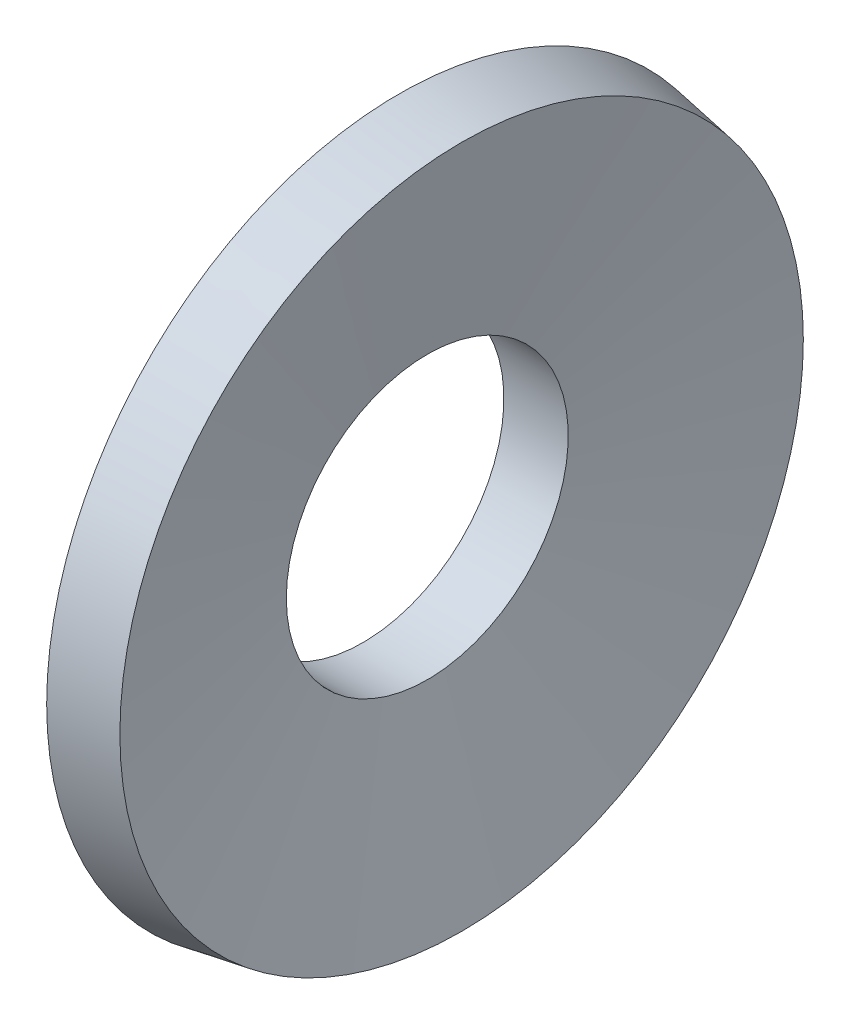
SolidWorks part; units mm, degrees
ref_plane "Plan1" through (0, 0, 0) normal (0, 0, 1) x (1, 0, 0)
ref_plane "Plan2" through (0, 0, 0) normal (0, 1, 0) x (1, 0, 0)
ref_plane "Plan3" through (0, 0, 0) normal (1, 0, 0) x (0, 0, -1)
sketch "Esquisse1" plane through (0, 0, 0) normal (0, 1, 0) x (1, 0, 0)
  line L0 (0, 2) -> (0.5129, 5)
  line L1 (0.9131, 2) -> (1.4, 4.8483)
  line L2 (0.5129, 5) -> (1.4, 4.8483)
  line L3 (0, 0) -> (12.6759, 0) construction
  line L4 (0, 2) -> (0.9131, 2)
  dimension "D1" = 2
  dimension "D2" = 5
  dimension "D4" = 1.4
  dimension "D3" = 0.9
revolve "Base-Révolution" add sketch "Esquisse1" angle 360 about L3
